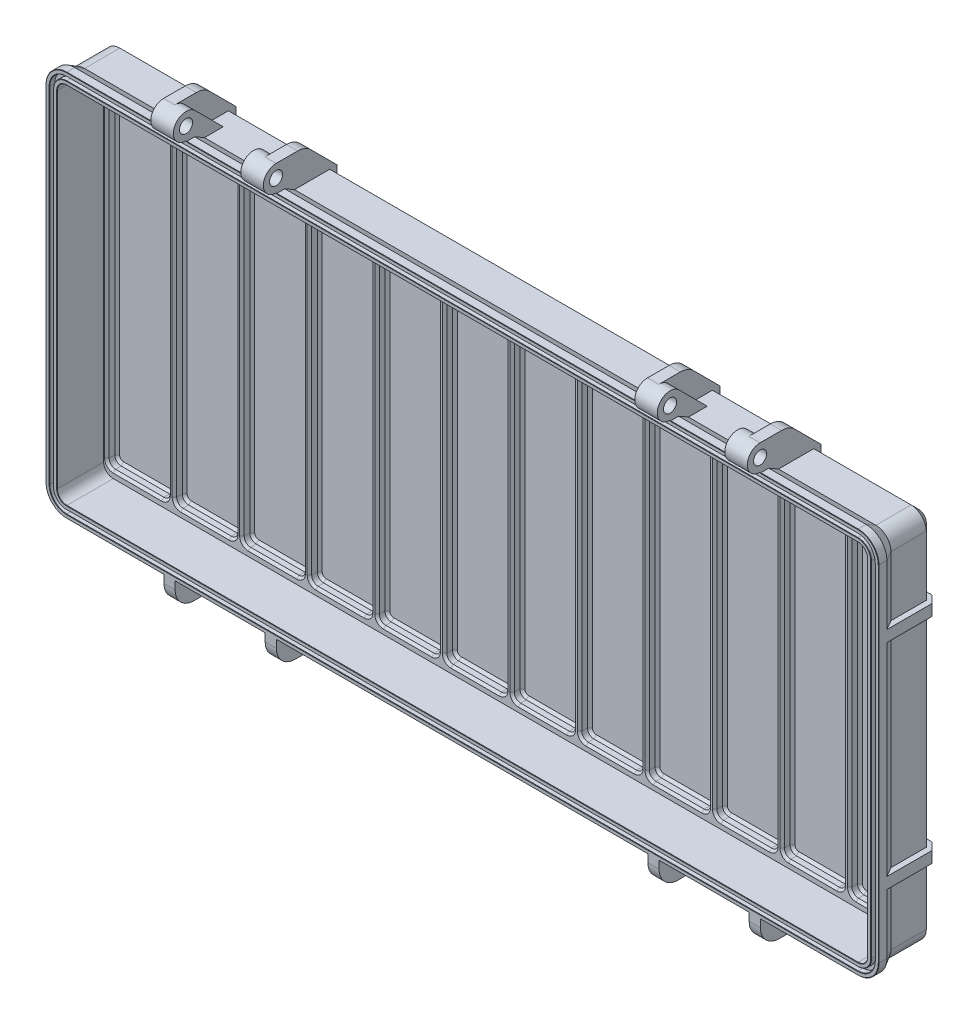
SolidWorks part; units mm, degrees
ref_plane "Front Plane" through (0, 0, 0) normal (0, 0, 1) x (1, 0, 0)
ref_plane "Top Plane" through (0, 0, 0) normal (0, 1, 0) x (1, 0, 0)
ref_plane "Right Plane" through (0, 0, 0) normal (1, 0, 0) x (0, 0, -1)
ref_plane "Plane1" through (0, 30, 0) normal (0, 1, 0) x (1, 0, 0)
ref_plane "Plane2" through (79.5, 0, 0) normal (1, 0, 0) x (0, 0, -1)
ref_plane "Plane3" through (64.5, 0, 0) normal (1, 0, 0) x (0, 0, -1)
sketch "Sketch1" plane through (0, 0, 0) normal (0, 0, 1) x (1, 0, 0)
  line L0 (-105.45, 50) -> (105.45, 50)
  line L1 (-108, 48.5) -> (108, 48.5) construction
  line L2 (-108, 48.5) -> (-108, -48.5) construction
  line L3 (-108, -48.5) -> (108, -48.5) construction
  line L4 (108, 48.5) -> (108, -48.5) construction
  line L5 (-108, 48.5) -> (108, -48.5) construction
  line L6 (-108, -48.5) -> (108, 48.5) construction
  line L7 (109.5, 45.95) -> (109.5, -45.95)
  line L8 (-105.45, -50) -> (105.45, -50)
  line L9 (-109.5, 45.95) -> (-109.5, -45.95)
  line L10 (-109.5, -50) -> (109.5, -50) construction
  line L11 (-109.5, 50) -> (-109.5, -50) construction
  line L12 (109.5, 50) -> (109.5, -50) construction
  line L13 (-109.5, 50) -> (109.5, 50) construction
  arc A0 (-105.45, -50) -> (-109.5, -45.95) centre (-105.45, -45.95) cw
  arc A1 (109.5, -45.95) -> (105.45, -50) centre (105.45, -45.95) cw
  arc A2 (105.45, 50) -> (109.5, 45.95) centre (105.45, 45.95) cw
  arc A3 (-105.45, 50) -> (-109.5, 45.95) centre (-105.45, 45.95) ccw
  point P0 (0, 0)
  dimension "D4" = 4.05
  dimension "D1" = 216
  dimension "D2" = 97
  dimension "D3" = 1.5
extrude "Boss-Extrude1" add sketch "Sketch1" against normal blind 1 draft 45
sketch "Sketch2" plane through (0, 0, 0) normal (0, 0, 1) x (1, 0, 0)
  line L4 (-105.45, -50) -> (105.45, -50)
  line L6 (-105.45, -50) -> (105.45, -50)
  line L12 (109.5, -45.95) -> (109.5, 45.95)
  line L14 (109.5, -45.95) -> (109.5, 45.95)
  line L16 (105.45, 50) -> (-105.45, 50)
  line L17 (105.45, 50) -> (-105.45, 50)
  line L18 (-109.5, 45.95) -> (-109.5, -45.95)
  line L19 (-109.5, 45.95) -> (-109.5, -45.95)
  arc A4 (-109.5, -45.95) -> (-105.45, -50) centre (-105.45, -45.95) ccw
  arc A6 (-109.5, -45.95) -> (-105.45, -50) centre (-105.45, -45.95) ccw
  arc A12 (105.45, -50) -> (109.5, -45.95) centre (105.45, -45.95) ccw
  arc A14 (105.45, -50) -> (109.5, -45.95) centre (105.45, -45.95) ccw
  arc A16 (109.5, 45.95) -> (105.45, 50) centre (105.45, 45.95) ccw
  arc A17 (109.5, 45.95) -> (105.45, 50) centre (105.45, 45.95) ccw
  arc A18 (-105.45, 50) -> (-109.5, 45.95) centre (-105.45, 45.95) ccw
  arc A19 (-105.45, 50) -> (-109.5, 45.95) centre (-105.45, 45.95) ccw
  dimension "D1" = 0
extrude "Boss-Extrude2" add sketch "Sketch2" along normal blind 13
sketch "Sketch3" plane through (0, 0, 13) normal (0, 0, 1) x (1, 0, 0)
  line L8 (-105.45, -51.5) -> (105.45, -51.5)
  line L10 (-105.45, -51.5) -> (105.45, -51.5)
  line L16 (111, -45.95) -> (111, 45.95)
  line L18 (111, -45.95) -> (111, 45.95)
  line L20 (105.45, 51.5) -> (-105.45, 51.5)
  line L21 (105.45, 51.5) -> (-105.45, 51.5)
  line L22 (-111, 45.95) -> (-111, -45.95)
  line L23 (-111, 45.95) -> (-111, -45.95)
  arc A8 (-111, -45.95) -> (-105.45, -51.5) centre (-105.45, -45.95) ccw
  arc A10 (-111, -45.95) -> (-105.45, -51.5) centre (-105.45, -45.95) ccw
  arc A16 (105.45, -51.5) -> (111, -45.95) centre (105.45, -45.95) ccw
  arc A18 (105.45, -51.5) -> (111, -45.95) centre (105.45, -45.95) ccw
  arc A20 (111, 45.95) -> (105.45, 51.5) centre (105.45, 45.95) ccw
  arc A21 (111, 45.95) -> (105.45, 51.5) centre (105.45, 45.95) ccw
  arc A22 (-105.45, 51.5) -> (-111, 45.95) centre (-105.45, 45.95) ccw
  arc A23 (-105.45, 51.5) -> (-111, 45.95) centre (-105.45, 45.95) ccw
  dimension "D1" = 1.5
extrude "Boss-Extrude3" add sketch "Sketch3" against normal blind 5 draft 30
sketch "Sketch4" plane through (0, 0, 13) normal (0, 0, 1) x (1, 0, 0)
  line L4 (-105.45, -51.5) -> (105.45, -51.5)
  line L6 (-105.45, -51.5) -> (105.45, -51.5)
  line L12 (111, -45.95) -> (111, 45.95)
  line L14 (111, -45.95) -> (111, 45.95)
  line L16 (105.45, 51.5) -> (-105.45, 51.5)
  line L17 (105.45, 51.5) -> (-105.45, 51.5)
  line L18 (-111, 45.95) -> (-111, -45.95)
  line L19 (-111, 45.95) -> (-111, -45.95)
  arc A4 (-111, -45.95) -> (-105.45, -51.5) centre (-105.45, -45.95) ccw
  arc A6 (-111, -45.95) -> (-105.45, -51.5) centre (-105.45, -45.95) ccw
  arc A12 (105.45, -51.5) -> (111, -45.95) centre (105.45, -45.95) ccw
  arc A14 (105.45, -51.5) -> (111, -45.95) centre (105.45, -45.95) ccw
  arc A16 (111, 45.95) -> (105.45, 51.5) centre (105.45, 45.95) ccw
  arc A17 (111, 45.95) -> (105.45, 51.5) centre (105.45, 45.95) ccw
  arc A18 (-105.45, 51.5) -> (-111, 45.95) centre (-105.45, 45.95) ccw
  arc A19 (-105.45, 51.5) -> (-111, 45.95) centre (-105.45, 45.95) ccw
  dimension "D1" = 0
extrude "Boss-Extrude4" add sketch "Sketch4" along normal blind 2.2
sketch "Sketch18" plane through (0, 0, -1) normal (0, 0, -1) x (-1, 0, 0)
  line L5 (-154.714, 73.9159) -> (154.714, 73.9159)
  line L6 (-154.714, 73.9159) -> (-154.714, -73.9159)
  line L7 (-154.714, -73.9159) -> (154.714, -73.9159)
  line L8 (107.5, -45.95) -> (107.5, 45.95)
  line L9 (105.45, 48) -> (-105.45, 48)
  line L10 (-107.5, 45.95) -> (-107.5, -45.95)
  line L11 (-105.45, -48) -> (105.45, -48)
  line L12 (107.5, -45.95) -> (107.5, 45.95)
  line L13 (105.45, 48) -> (-105.45, 48)
  line L14 (-107.5, 45.95) -> (-107.5, -45.95)
  line L15 (-105.45, -48) -> (105.45, -48)
  line L16 (154.714, 73.9159) -> (154.714, -73.9159)
  line L17 (-154.714, 73.9159) -> (154.714, -73.9159) construction
  line L18 (-154.714, -73.9159) -> (154.714, 73.9159) construction
  arc A8 (105.45, -48) -> (107.5, -45.95) centre (105.45, -45.95) ccw
  arc A9 (107.5, 45.95) -> (105.45, 48) centre (105.45, 45.95) ccw
  arc A10 (-105.45, 48) -> (-107.5, 45.95) centre (-105.45, 45.95) ccw
  arc A11 (-107.5, -45.95) -> (-105.45, -48) centre (-105.45, -45.95) ccw
  arc A12 (105.45, -48) -> (107.5, -45.95) centre (105.45, -45.95) ccw
  arc A13 (107.5, 45.95) -> (105.45, 48) centre (105.45, 45.95) ccw
  arc A14 (-105.45, 48) -> (-107.5, 45.95) centre (-105.45, 45.95) ccw
  arc A15 (-107.5, -45.95) -> (-105.45, -48) centre (-105.45, -45.95) ccw
  point P0 (0, 0)
  dimension "D1" = 1
extrude "Cut-Extrude7" cut sketch "Sketch18" against normal blind 5 draft 45
sketch "Sketch5" plane through (0, 0, 15.2) normal (0, 0, 1) x (1, 0, 0)
  line L8 (-105.45, -48.5) -> (105.45, -48.5)
  line L9 (108, -45.95) -> (108, 45.95)
  line L10 (105.45, 48.5) -> (-105.45, 48.5)
  line L11 (-108, 45.95) -> (-108, -45.95)
  line L12 (-105.45, -48.5) -> (105.45, -48.5)
  line L13 (108, -45.95) -> (108, 45.95)
  line L14 (105.45, 48.5) -> (-105.45, 48.5)
  line L15 (-108, 45.95) -> (-108, -45.95)
  arc A8 (-108, -45.95) -> (-105.45, -48.5) centre (-105.45, -45.95) ccw
  arc A9 (105.45, -48.5) -> (108, -45.95) centre (105.45, -45.95) ccw
  arc A10 (108, 45.95) -> (105.45, 48.5) centre (105.45, 45.95) ccw
  arc A11 (-105.45, 48.5) -> (-108, 45.95) centre (-105.45, 45.95) ccw
  arc A12 (-108, -45.95) -> (-105.45, -48.5) centre (-105.45, -45.95) ccw
  arc A13 (105.45, -48.5) -> (108, -45.95) centre (105.45, -45.95) ccw
  arc A14 (108, 45.95) -> (105.45, 48.5) centre (105.45, 45.95) ccw
  arc A15 (-105.45, 48.5) -> (-108, 45.95) centre (-105.45, 45.95) ccw
  dimension "D1" = 3
extrude "Cut-Extrude1" cut sketch "Sketch5" against normal blind 12.45
sketch "Sketch6" plane through (0, 0, 2.75) normal (0, 0, 1) x (1, 0, 0)
  line L9 (-105.45, 48.25) -> (-92.55, 48.25)
  line L10 (-107.75, 45.95) -> (-107.75, -45.95)
  line L11 (-107.75, 45.95) -> (-107.75, -44.95)
  line L12 (-90.25, 45.95) -> (-90.25, -44.95)
  line L13 (-92.55, -47.25) -> (-105.45, -47.25)
  arc A6 (-90.25, -44.95) -> (-92.55, -47.25) centre (-92.55, -44.95) cw
  arc A7 (-92.55, 48.25) -> (-90.25, 45.95) centre (-92.55, 45.95) cw
  arc A8 (-107.75, -45.95) -> (-105.45, -48.25) centre (-105.45, -45.95) ccw
  arc A9 (-105.45, 48.25) -> (-107.75, 45.95) centre (-105.45, 45.95) ccw
  arc A11 (-105.45, 48.25) -> (-107.75, 45.95) centre (-105.45, 45.95) ccw
  arc A12 (-105.45, -47.25) -> (-107.75, -44.95) centre (-105.45, -44.95) cw
  dimension "D2" = 2.3
  dimension "D5" = 2.3
  dimension "D3" = 17.5
  dimension "D4" = 95.5
  dimension "D1" = 0.25
extrude "Cut-Extrude2" cut sketch "Sketch6" against normal blind 0.6 draft 45
sketch "Sketch7" plane through (0, 0, 2.15) normal (0, 0, 1) x (1, 0, 0)
  line L4 (-90.85, -44.95) -> (-90.85, 45.95)
  line L5 (-92.55, 47.65) -> (-105.45, 47.65)
  line L6 (-107.15, 45.95) -> (-107.15, -44.95)
  line L7 (-105.45, -46.65) -> (-92.55, -46.65)
  line L8 (-90.85, -44.95) -> (-90.85, 45.95)
  line L9 (-92.55, 47.65) -> (-105.45, 47.65)
  line L10 (-107.15, 45.95) -> (-107.15, -44.95)
  line L11 (-105.45, -46.65) -> (-92.55, -46.65)
  arc A4 (-92.55, -46.65) -> (-90.85, -44.95) centre (-92.55, -44.95) ccw
  arc A5 (-90.85, 45.95) -> (-92.55, 47.65) centre (-92.55, 45.95) ccw
  arc A6 (-105.45, 47.65) -> (-107.15, 45.95) centre (-105.45, 45.95) ccw
  arc A7 (-107.15, -44.95) -> (-105.45, -46.65) centre (-105.45, -44.95) ccw
  arc A8 (-92.55, -46.65) -> (-90.85, -44.95) centre (-92.55, -44.95) ccw
  arc A9 (-90.85, 45.95) -> (-92.55, 47.65) centre (-92.55, 45.95) ccw
  arc A10 (-105.45, 47.65) -> (-107.15, 45.95) centre (-105.45, 45.95) ccw
  arc A12 (-107.15, -44.95) -> (-105.45, -46.65) centre (-105.45, -44.95) ccw
  dimension "D1" = 0
extrude "Cut-Extrude3" cut sketch "Sketch7" against normal blind 1.5
sketch "Sketch8" plane through (0, 0, 0.65) normal (0, 0, 1) x (1, 0, 0)
  line L4 (-90.85, -44.95) -> (-90.85, 45.95)
  line L5 (-92.55, 47.65) -> (-105.45, 47.65)
  line L6 (-107.15, 45.95) -> (-107.15, -44.95)
  line L7 (-105.45, -46.65) -> (-92.55, -46.65)
  line L8 (-90.85, -44.95) -> (-90.85, 45.95)
  line L9 (-92.55, 47.65) -> (-105.45, 47.65)
  line L10 (-107.15, 45.95) -> (-107.15, -44.95)
  line L11 (-105.45, -46.65) -> (-92.55, -46.65)
  arc A4 (-92.55, -46.65) -> (-90.85, -44.95) centre (-92.55, -44.95) ccw
  arc A5 (-90.85, 45.95) -> (-92.55, 47.65) centre (-92.55, 45.95) ccw
  arc A6 (-105.45, 47.65) -> (-107.15, 45.95) centre (-105.45, 45.95) ccw
  arc A7 (-107.15, -44.95) -> (-105.45, -46.65) centre (-105.45, -44.95) ccw
  arc A8 (-92.55, -46.65) -> (-90.85, -44.95) centre (-92.55, -44.95) ccw
  arc A9 (-90.85, 45.95) -> (-92.55, 47.65) centre (-92.55, 45.95) ccw
  arc A10 (-105.45, 47.65) -> (-107.15, 45.95) centre (-105.45, 45.95) ccw
  arc A11 (-107.15, -44.95) -> (-105.45, -46.65) centre (-105.45, -44.95) ccw
  dimension "D1" = 0
extrude "Cut-Extrude4" cut sketch "Sketch8" against normal blind 0.65 draft 45
pattern_linear "LPattern1" count 12 spacing 18 along (1, 0, 0) of "Cut-Extrude2", "Cut-Extrude3", "Cut-Extrude4"
sketch "Sketch9" plane through (0, 0, 15.2) normal (0, 0, 1) x (1, 0, 0)
  line L8 (-105.45, -50.5) -> (105.45, -50.5)
  line L9 (110, -45.95) -> (110, 45.95)
  line L10 (105.45, 50.5) -> (-105.45, 50.5)
  line L11 (-110, 45.95) -> (-110, -45.95)
  line L12 (-105.45, -50.5) -> (105.45, -50.5)
  line L13 (110, -45.95) -> (110, 45.95)
  line L14 (105.45, 50.5) -> (-105.45, 50.5)
  line L15 (-110, 45.95) -> (-110, -45.95)
  line L20 (-105.45, -49.5) -> (105.45, -49.5)
  line L21 (109, -45.95) -> (109, 45.95)
  line L22 (105.45, 49.5) -> (-105.45, 49.5)
  line L23 (-109, 45.95) -> (-109, -45.95)
  line L24 (-105.45, -49.5) -> (105.45, -49.5)
  line L25 (109, -45.95) -> (109, 45.95)
  line L26 (105.45, 49.5) -> (-105.45, 49.5)
  line L27 (-109, 45.95) -> (-109, -45.95)
  arc A8 (-110, -45.95) -> (-105.45, -50.5) centre (-105.45, -45.95) ccw
  arc A9 (105.45, -50.5) -> (110, -45.95) centre (105.45, -45.95) ccw
  arc A10 (110, 45.95) -> (105.45, 50.5) centre (105.45, 45.95) ccw
  arc A11 (-105.45, 50.5) -> (-110, 45.95) centre (-105.45, 45.95) ccw
  arc A12 (-110, -45.95) -> (-105.45, -50.5) centre (-105.45, -45.95) ccw
  arc A13 (105.45, -50.5) -> (110, -45.95) centre (105.45, -45.95) ccw
  arc A14 (110, 45.95) -> (105.45, 50.5) centre (105.45, 45.95) ccw
  arc A15 (-105.45, 50.5) -> (-110, 45.95) centre (-105.45, 45.95) ccw
  arc A20 (-109, -45.95) -> (-105.45, -49.5) centre (-105.45, -45.95) ccw
  arc A21 (105.45, -49.5) -> (109, -45.95) centre (105.45, -45.95) ccw
  arc A22 (109, 45.95) -> (105.45, 49.5) centre (105.45, 45.95) ccw
  arc A23 (-105.45, 49.5) -> (-109, 45.95) centre (-105.45, 45.95) ccw
  arc A24 (-109, -45.95) -> (-105.45, -49.5) centre (-105.45, -45.95) ccw
  arc A25 (105.45, -49.5) -> (109, -45.95) centre (105.45, -45.95) ccw
  arc A26 (109, 45.95) -> (105.45, 49.5) centre (105.45, 45.95) ccw
  arc A27 (-105.45, 49.5) -> (-109, 45.95) centre (-105.45, 45.95) ccw
  dimension "D1" = 1
  dimension "D2" = 2
extrude "Cut-Extrude5" cut sketch "Sketch9" against normal blind 1.4
sketch "Sketch10" plane through (0, 30, 0) normal (0, 1, 0) x (1, 0, 0)
  line L1 (-109.5, -10.4019) -> (-109.5, -1) construction
  line L2 (-109.5, -10.4019) -> (-111, -13) construction
  line L4 (-109.5, -10.4019) -> (-109.5, -1)
  line L5 (-109.5, -10.4019) -> (-111, -13)
  line L6 (-107.5, 1) -> (-109, 1)
  line L7 (-109, 1) -> (-111, -1)
  line L8 (-111, -1) -> (-111, -13)
  line L9 (-109.5, -1) -> (-107.5, 1) construction
  line L10 (-109.5, -1) -> (-107.5, 1)
extrude "Boss-Extrude5" add sketch "Sketch10" against normal blind 3
mirror "Mirror1" about plane through (0, 0, 0) normal (0, 1, 0) of "Boss-Extrude5"
mirror "Mirror2" about plane through (0, 0, 0) normal (1, 0, 0) of "Mirror1", "Boss-Extrude5"
chamfer "Chamfer1" distance 0.1 angle 45 16 edges at (108, 0, 15.2) (107.2531, 47.7531, 15.2) (107.2531, -47.7531, 15.2) (0, 48.5, 15.2) (0, -48.5, 15.2) (-107.2531, 47.7531, 15.2) (-107.2531, -47.7531, 15.2) (-108, 0, 15.2) (111, 0, 15.2) (109.3744, 49.8744, 15.2) (109.3744, -49.8744, 15.2) (0, 51.5, 15.2) (0, -51.5, 15.2) (-109.3744, 49.8744, 15.2) (-109.3744, -49.8744, 15.2) (-111, 0, 15.2)
chamfer "Chamfer2" distance 0.1 angle 45 16 edges at (109, 0, 15.2) (107.9602, 48.4602, 15.2) (107.9602, -48.4602, 15.2) (0, 49.5, 15.2) (0, -49.5, 15.2) (-107.9602, 48.4602, 15.2) (-107.9602, -48.4602, 15.2) (-109, 0, 15.2) (110, 0, 15.2) (108.6673, 49.1673, 15.2) (108.6673, -49.1673, 15.2) (0, 50.5, 15.2) (0, -50.5, 15.2) (-108.6673, 49.1673, 15.2) (-108.6673, -49.1673, 15.2) (-110, 0, 15.2)
sketch "Sketch12" plane through (79.5, 0, 0) normal (1, 0, 0) x (0, 0, -1)
  line L0 (-15.1, 51.5) -> (-13, 51.5) construction
  line L1 (-15.2, 51.4) -> (-15.2, 45.95) construction
  line L3 (-10.4019, 50) -> (-1, 50) construction
  line L4 (-10.4019, 50) -> (-13, 51.5) construction
  line L5 (-15.1, 51.5) -> (-15.2, 51.4) construction
  line L7 (-10.4019, 50) -> (-1, 50)
  line L8 (-10.4019, 50) -> (-13, 51.5)
  line L9 (-15.1, 51.5) -> (-13, 51.5)
  line L10 (-15.1, 51.5) -> (-15.2, 51.4)
  line L11 (1, 48) -> (1, 50)
  line L12 (1, 50) -> (-6.0355, 57.0355)
  line L13 (-9.5711, 58.5) -> (-15.3, 58.5)
  line L14 (-15.2, 51.4) -> (-15.2, 51.6)
  line L15 (-15.2, 51.6) -> (-15.3, 51.7)
  line L16 (-1, 50) -> (1, 48) construction
  line L17 (-1, 50) -> (1, 48)
  circle A0 centre (-15.3, 55.1) radius 1.75
  arc A1 (-15.3, 58.5) -> (-15.3, 51.7) centre (-15.3, 55.1) ccw
  arc A2 (-6.0355, 57.0355) -> (-9.5711, 58.5) centre (-9.5711, 53.5) ccw
  dimension "D3" = 6.8
  dimension "D4" = 3.5
  dimension "D6" = 5
  dimension "D1" = 3.6
  dimension "D2" = 0.1
  dimension "D5" = 135
  dimension "D7" = 0.2
extrude "Boss-Extrude6" add sketch "Sketch12" against normal blind 3
sketch "Sketch13" plane through (76.5, 0, 0) normal (-1, 0, 0) x (0, 0, 1)
  line L0 (10.4019, 50) -> (1, 50) construction
  line L1 (13, 51.5) -> (10.4019, 50) construction
  line L2 (15.1, 51.5) -> (13, 51.5) construction
  line L3 (15.2, 51.4) -> (15.1, 51.5) construction
  line L4 (15.2, 51.6) -> (15.2, 51.4) construction
  line L5 (15.3, 51.7) -> (15.2, 51.6) construction
  line L6 (10.4019, 50) -> (5.3917, 50)
  line L7 (13, 51.5) -> (10.4019, 50)
  line L8 (15.1, 51.5) -> (13, 51.5)
  line L9 (15.2, 51.4) -> (15.1, 51.5)
  line L10 (15.2, 51.6) -> (15.2, 51.4)
  line L11 (15.3, 51.7) -> (15.2, 51.6)
  line L12 (12.8958, 57.5042) -> (5.3917, 50)
  line L13 (-1, 50) -> (6.0355, 57.0355) construction
  arc A0 (15.3, 51.7) -> (15.3, 58.5) centre (15.3, 55.1) ccw construction
  circle A1 centre (15.3, 55.1) radius 1.75 construction
  arc A2 (15.3, 51.7) -> (12.8958, 57.5042) centre (15.3, 55.1) ccw
  circle A3 centre (15.3, 55.1) radius 1.75
extrude "Boss-Extrude7" add sketch "Sketch13" along normal blind 3
mirror "Mirror3" about plane through (64.5, 0, 0) normal (1, 0, 0) of "Boss-Extrude7", "Boss-Extrude6"
mirror "Mirror4" about plane through (0, 0, 0) normal (1, 0, 0) of "Mirror3", "Boss-Extrude6", "Boss-Extrude7"
sketch "Sketch14" plane through (79.5, 0, 0) normal (1, 0, 0) x (0, 0, -1)
  line L1 (-10.4019, -50) -> (-1, -50) construction
  line L2 (-10.4019, -50) -> (-13, -51.5) construction
  line L3 (-15.1, -51.5) -> (-13, -51.5) construction
  line L4 (-15.2, -51.4) -> (-15.1, -51.5) construction
  line L6 (-10.4019, -50) -> (-1, -50)
  line L7 (-10.4019, -50) -> (-13, -51.5)
  line L8 (-15.1, -51.5) -> (-13, -51.5)
  line L9 (-15.2, -51.4) -> (-15.1, -51.5)
  line L10 (-15.2, -51.4) -> (-15.2, -53.5)
  line L11 (-10.2, -58.5) -> (-4, -58.5)
  line L13 (1, -48) -> (1, -53.5)
  line L15 (-1, -50) -> (1, -48) construction
  line L16 (-1, -50) -> (1, -48)
  arc A0 (1, -53.5) -> (-4, -58.5) centre (-4, -53.5) cw
  arc A1 (-15.2, -53.5) -> (-10.2, -58.5) centre (-10.2, -53.5) ccw
  circle A2 centre (-7.2, -54.3) radius 1.75
  dimension "D2" = 5
  dimension "D5" = 3.5
  dimension "D1" = 7
  dimension "D3" = 8
  dimension "D4" = 2.8
extrude "Boss-Extrude8" add sketch "Sketch14" against normal blind 3
pattern_linear "LPattern2" count 2 spacing 27 along (-1, 0, 0) of "Boss-Extrude8"
mirror "Mirror5" about plane through (0, 0, 0) normal (1, 0, 0) of "LPattern2", "Boss-Extrude8"
sketch "Sketch15" plane through (-109.5, 0, 0) normal (-1, 0, 0) x (0, 0, 1)
  line L0 (3, 27) -> (3, -27) construction
  line L1 (1, 27) -> (13, 27) construction
  line L2 (1, -27) -> (13, -27) construction
  line L4 (-1, -27) -> (-1, 27) construction
  text T0 "10K - 99K" font "Verdana" height 5
  dimension "5" = 4
extrude "Boss-Extrude9" [suppressed] add sketch "Sketch15" along normal blind 0.4
